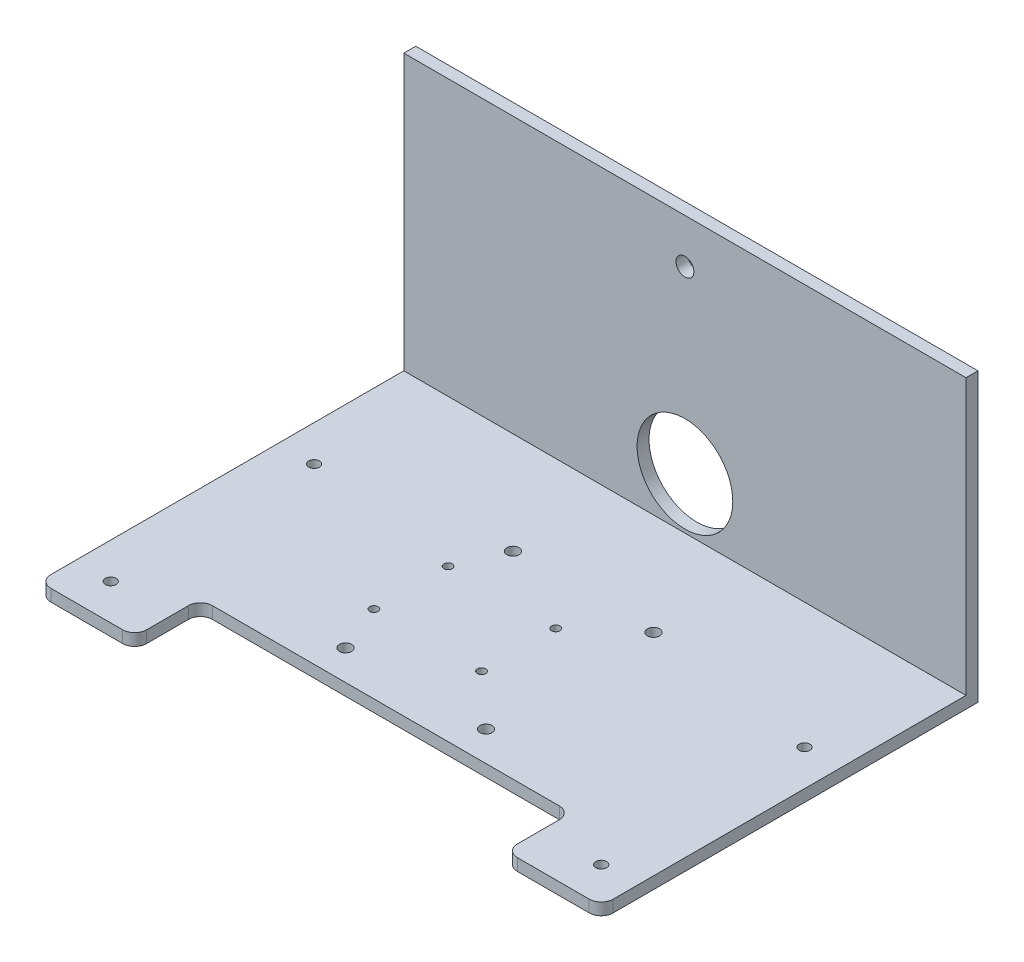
SolidWorks part; units mm, degrees
ref_plane "Plan1" through (0, 0, 0) normal (0, 0, 1) x (1, 0, 0)
ref_plane "Plan2" through (0, 0, 0) normal (0, 1, 0) x (1, 0, 0)
ref_plane "Plan3" through (0, 0, 0) normal (1, 0, 0) x (0, 0, -1)
sketch "Esquisse1" plane through (0, 0, 0) normal (0, 1, 0) x (1, 0, 0)
  line L0 (0, 0) -> (0, 315) construction
  line L1 (165, 0) -> (225, 0)
  line L2 (-145, 55) -> (145, 55)
  line L3 (-235, 315) -> (235, 315)
  line L4 (235, 10) -> (235, 315)
  line L5 (155, 45) -> (155, 10)
  line L6 (-155, 45) -> (-155, 10)
  line L7 (-235, 10) -> (-235, 315)
  line L8 (-165, 0) -> (-225, 0)
  arc A0 (155, 45) -> (145, 55) centre (145, 45) ccw
  arc A1 (165, 0) -> (155, 10) centre (165, 10) cw
  arc A2 (235, 10) -> (225, 0) centre (225, 10) cw
  circle A4 centre (205, 200) radius 4.5
  circle A5 centre (205, 30) radius 4.5
  circle A6 centre (-205, 30) radius 4.5
  circle A7 centre (-205, 200) radius 4.5
  arc A9 (-235, 10) -> (-225, 0) centre (-225, 10) ccw
  arc A10 (-165, 0) -> (-155, 10) centre (-165, 10) ccw
  arc A11 (-155, 45) -> (-145, 55) centre (-145, 45) cw
  circle A12 centre (-75, 182) radius 3.5
  circle A13 centre (-75, 120) radius 3.5
  circle A14 centre (15, 182) radius 3.5
  circle A15 centre (15, 120) radius 3.5
  point P14 (235, 0)
  point P17 (235, 315)
  point P38 (0, 55)
  dimension "D5" = 10
  dimension "D6" = 30
  dimension "D7" = 170
  dimension "D9" = 9
  dimension "D10" = 9
  dimension "D11" = 7
  dimension "D12" = 7
  dimension "D13" = 7
  dimension "D14" = 7
  dimension "D17" = 90
  dimension "D1" = 235
  dimension "D2" = 315
  dimension "D3" = 55
  dimension "D4" = 80
  dimension "D8" = 205
  dimension "D15" = 65
  dimension "D16" = 62
  dimension "D18" = 160
extrude "Base-Extrusion" add sketch "Esquisse1" along normal blind 10
sketch "Esquisse2" plane through (0, 10, 0) normal (0, 1, 0) x (-1, 0, 0)
  line L0 (145, -55) -> (-145, -55) construction
  line L1 (-235, -315) -> (235, -315) construction
  circle A0 centre (58.75, -80) radius 5.125
  circle A1 centre (-58.75, -80) radius 5.125
  circle A2 centre (58.75, -220) radius 5.125
  circle A3 centre (-58.75, -220) radius 5.125
  dimension "D2" = 58.75
  dimension "D3" = 10.25
  dimension "D4" = 10.25
  dimension "D5" = 10.25
  dimension "D6" = 10.25
  dimension "D8" = 95
  dimension "D1" = 58.75
  dimension "D7" = 25
extrude "Enlèv. mat.-Extru.1" cut sketch "Esquisse2" against normal through all
ref_plane "Plan4" through (0, 0, -220) normal (0, 0, -1) x (-1, 0, 0)
ref_plane "Plan5" through (0, 0, -80) normal (0, 0, 1) x (1, 0, 0)
sketch "Esquisse3" plane through (0, 10, 0) normal (0, 1, 0) x (1, 0, 0)
  line L0 (235, 10) -> (235, 315) construction
  line L1 (-235, 315) -> (235, 315)
  line L2 (-235, 315) -> (-235, 305)
  line L3 (-235, 305) -> (235, 305)
  line L4 (235, 315) -> (235, 305)
  dimension "D1" = 10
extrude "Boss.-Extru.1" add sketch "Esquisse3" along normal blind 230
sketch "Esquisse4" plane through (0, 0, -305) normal (0, 0, 1) x (1, 0, 0)
  line L0 (-235, 240) -> (-235, 10) construction
  line L1 (-235, 10) -> (235, 10) construction
  circle A0 centre (0, 202.9) radius 7.5
  dimension "D1" = 15
  dimension "D2" = 235
  dimension "D3" = 192.9
extrude "Enlèv. mat.-Extru.2" cut sketch "Esquisse4" against normal blind 100
sketch "Esquisse5" plane through (0, 0, -305) normal (0, 0, 1) x (1, 0, 0)
  line L0 (-235, 10) -> (235, 10) construction
  circle A0 centre (0, 52.9) radius 40
  dimension "D1" = 80
  dimension "D2" = 42.9
extrude "Enlèv. mat.-Extru.3" cut sketch "Esquisse5" against normal blind 100
